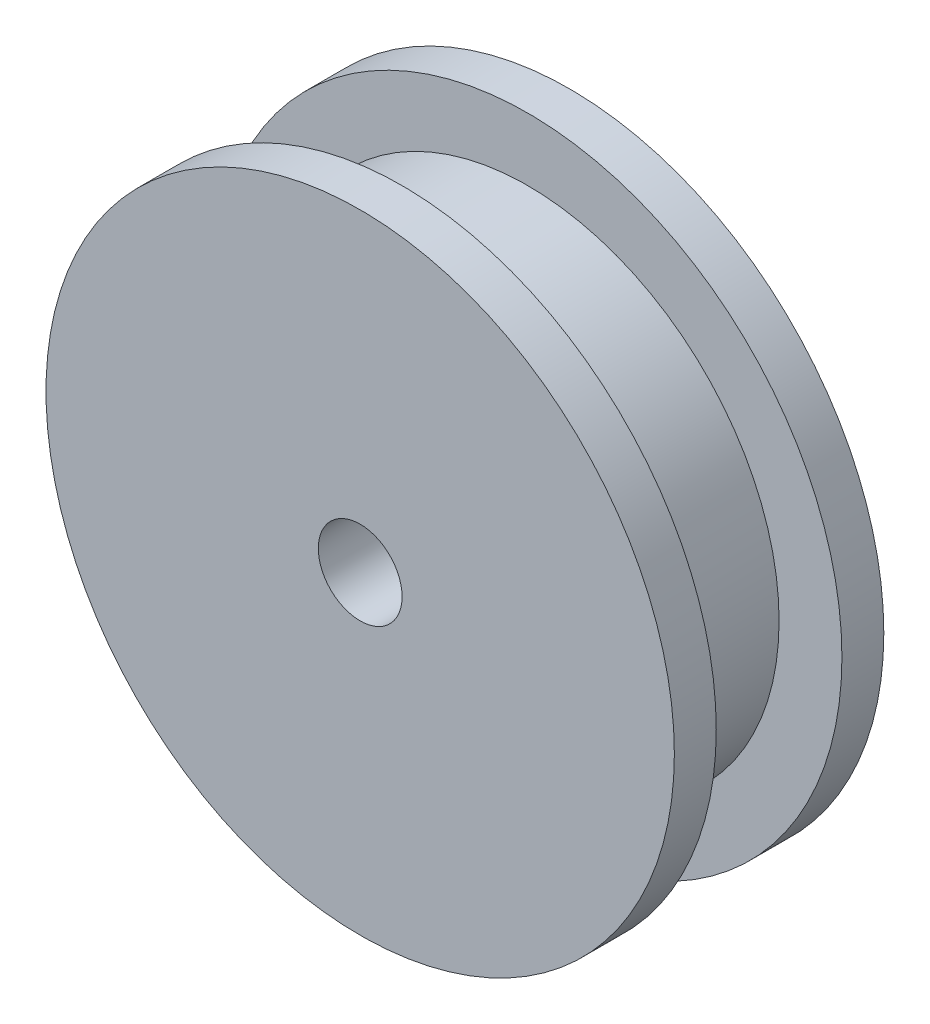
SolidWorks part; units mm, degrees
ref_plane "Front" through (0, 0, 0) normal (0, 0, 1) x (1, 0, 0)
ref_plane "Top" through (0, 0, 0) normal (0, 1, 0) x (1, 0, 0)
ref_plane "Right" through (0, 0, 0) normal (1, 0, 0) x (0, 0, -1)
sketch "Sketch1" plane through (0, 0, 0) normal (1, 0, 0) x (0, 0, -1)
  line L0 (-51.1059, 0) -> (51.1059, 0) construction
  line L1 (19.05, 76.2) -> (19.05, 95.25)
  line L2 (19.05, 95.25) -> (31.75, 95.25)
  line L3 (31.75, 95.25) -> (31.75, 12.7)
  line L4 (19.05, 76.2) -> (-19.05, 76.2)
  line L6 (0, 0) -> (0, 76.2) construction
  line L7 (-31.75, 95.25) -> (-31.75, 12.7)
  line L8 (-19.05, 95.25) -> (-31.75, 95.25)
  line L9 (-19.05, 76.2) -> (-19.05, 95.25)
  line L10 (31.75, 12.7) -> (-31.75, 12.7)
  dimension "D1" = 12.7
  dimension "D2" = 76.2
  dimension "D3" = 38.1
  dimension "D4" = 12.7
  dimension "D5" = 19.05
revolve "Revolve2" add sketch "Sketch1" angle 360 about L0
